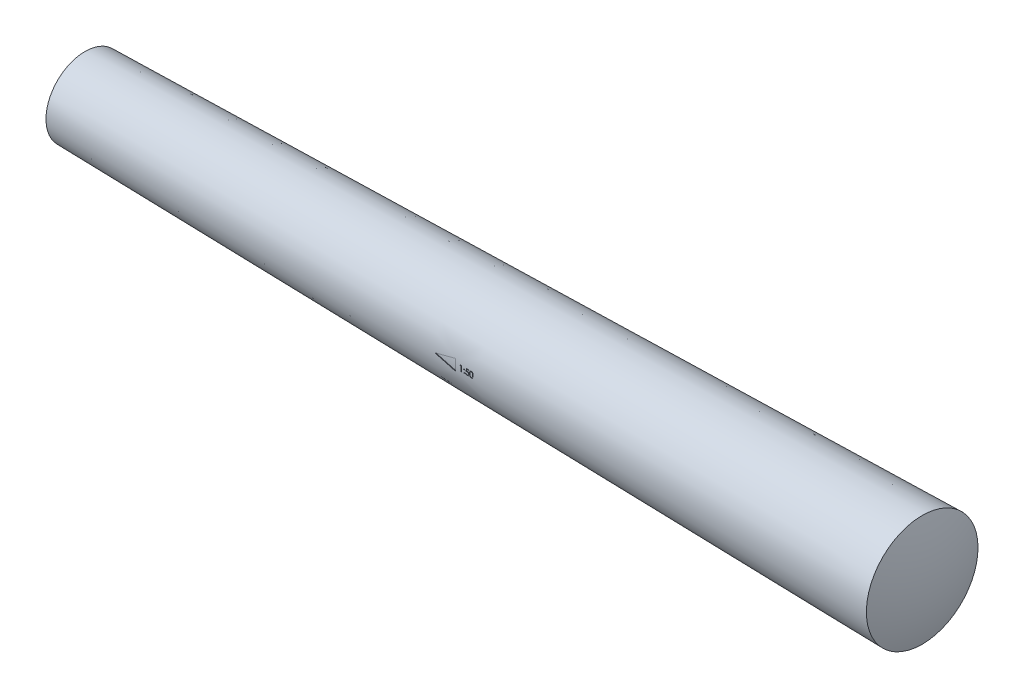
SolidWorks part; units mm, degrees
ref_plane "Front Plane" through (0, 0, 0) normal (0, 0, 1) x (1, 0, 0)
ref_plane "Top Plane" through (0, 0, 0) normal (0, 1, 0) x (1, 0, 0)
ref_plane "Right Plane" through (0, 0, 0) normal (1, 0, 0) x (0, 0, -1)
sketch "Sketch1" plane through (0, 0, 0) normal (1, 0, 0) x (0, 0, -1)
  circle A0 centre (0, 0) radius 7
  dimension "D1" = 14
extrude "Extrude1" add sketch "Sketch1" along normal mid plane 150
draft "Draft1" type of draft neutral plane draft angle 1.146 faces to draft 1 parameters "D1"=1.146
sketch "Sketch2" plane through (0, 0, 0) normal (0, 0, 1) x (1, 0, 0)
  line L0 (-75, 0) -> (-75, 7)
  line L1 (-75, 7) -> (-75, -7) construction
  line L2 (-75, 0) -> (-76.6, 0)
  line L3 (-76.6, 0) -> (-76.6, -8.5) construction
  line L4 (75, 0) -> (75, 10.0001)
  line L5 (75, -10.0001) -> (75, 10.0001) construction
  line L6 (75, 0) -> (76.6, 0)
  line L7 (76.6, 0) -> (76.6, -8.5) construction
  line L8 (-75, -7) -> (75, -10.0001) construction
  arc A0 (-76.6, 0) -> (-75, 7) centre (-60.4875, 0) cw
  arc A1 (76.6, 0) -> (75, 10.0001) centre (44.5494, 0) ccw
  point P14 (0, -8.5)
revolve "Revolve1" add sketch "Sketch2" angle 360 about L2
sketch "Sketch5" plane through (0, 0, 0) normal (0, 0, 1) x (1, 0, 0)
  line L0 (0, 8.5) -> (0, -8.5) construction
  line L1 (75, 10.0001) -> (-75, 7) construction
  line L2 (-75, -7) -> (75, -10.0001) construction
ref_plane "Plane2" through (0, 0, 0) normal (-0.02, 0, 0.9998) x (0.9998, 0, 0.02)
sketch "Sketch6" plane through (0, 0, 0) normal (-0.02, 0, 0.9998) x (0.9998, 0, 0.02)
  line L0 (0, 0) -> (0, 1)
  line L1 (0, 8.5) -> (0, -8.5) construction
  line L2 (0, 1) -> (-3.7321, 0)
  line L3 (-3.7321, 0) -> (0, -1)
  line L4 (0, -1) -> (0, 0)
  line L5 (0, -0.5) -> (4, -0.5) construction
  text T0 "1:50" font "Century Gothic" height 1
  dimension "D1" = 2
  dimension "D2" = 30
  dimension "D3" = 4
wrap "Wrap2" sketch "Sketch6" wrap type deboss source sketch "Sketch6" thickness 0.1 parameters "D1"=0.1
equation "\"D2@Sketch2\" = \"D1@Sketch2\""
